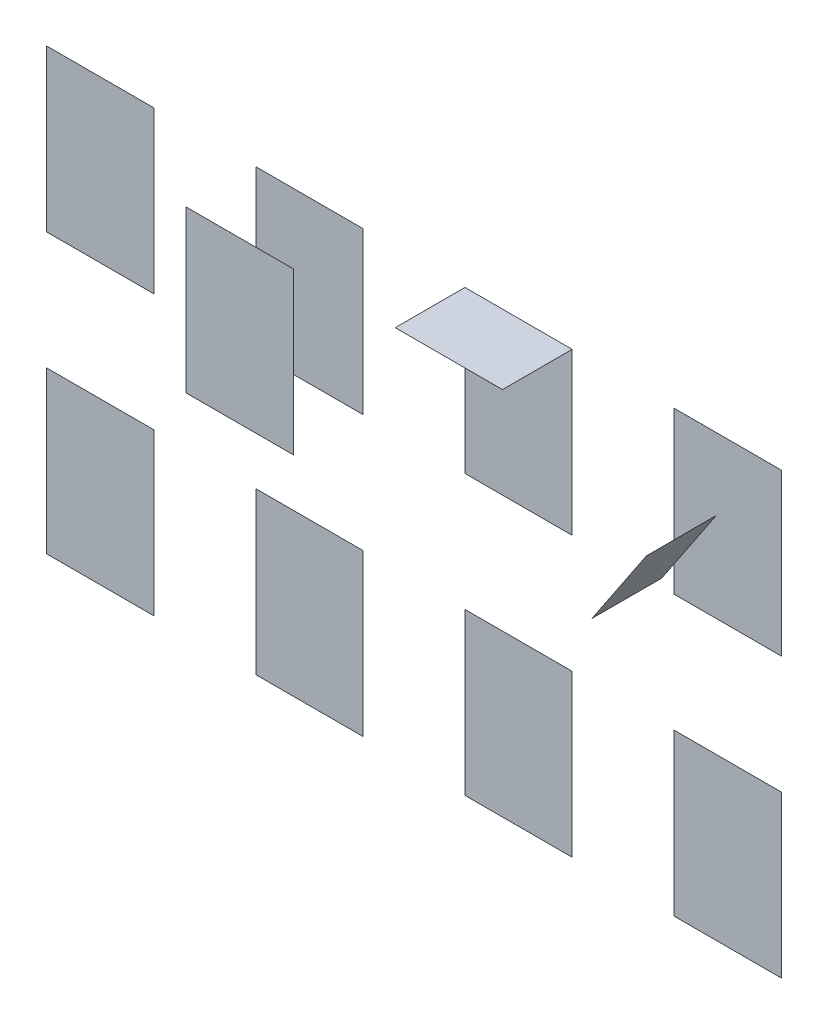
SolidWorks part; units mm, degrees
ref_plane "Front Plane" through (0, 0, 0) normal (0, 0, 1) x (1, 0, 0)
ref_plane "Top Plane" through (0, 0, 0) normal (0, 1, 0) x (1, 0, 0)
ref_plane "Right Plane" through (0, 0, 0) normal (1, 0, 0) x (0, 0, -1)
sketch "Sketch2" plane through (0, 0, 0) normal (0, 0, 1) x (1, 0, 0)
  line L0 (210.0743, 46.6612) -> (210.0743, -45.7795)
  line L1 (90.0743, 46.6612) -> (151.6014, 46.6612)
  line L2 (90.0743, 46.6612) -> (90.0743, -45.7795)
  line L3 (90.0743, -45.7795) -> (151.6014, -45.7795)
  line L4 (151.6014, 46.6612) -> (151.6014, -45.7795)
  line L5 (210.0743, 46.6612) -> (271.6014, 46.6612)
  line L6 (271.6014, 46.6612) -> (271.6014, -45.7795)
  line L7 (210.0743, -45.7795) -> (271.6014, -45.7795)
  line L8 (330.0743, 46.6612) -> (330.0743, -45.7795)
  line L9 (330.0743, 46.6612) -> (391.6014, 46.6612)
  line L10 (391.6014, 46.6612) -> (391.6014, -45.7795)
  line L11 (330.0743, -45.7795) -> (391.6014, -45.7795)
  line L12 (-29.9257, 46.6612) -> (-29.9257, -45.7795)
  line L13 (-29.9257, 46.6612) -> (31.6014, 46.6612)
  line L14 (31.6014, 46.6612) -> (31.6014, -45.7795)
  line L15 (-29.9257, -45.7795) -> (31.6014, -45.7795)
  line L16 (-29.9257, -113.3388) -> (-29.9257, -205.7795)
  line L17 (-29.9257, -205.7795) -> (31.6014, -205.7795)
  line L18 (31.6014, -113.3388) -> (31.6014, -205.7795)
  line L19 (-29.9257, -113.3388) -> (31.6014, -113.3388)
  line L20 (90.0743, -113.3388) -> (90.0743, -205.7795)
  line L21 (90.0743, -113.3388) -> (151.6014, -113.3388)
  line L22 (151.6014, -113.3388) -> (151.6014, -205.7795)
  line L23 (90.0743, -205.7795) -> (151.6014, -205.7795)
  line L24 (210.0743, -113.3388) -> (210.0743, -205.7795)
  line L25 (210.0743, -205.7795) -> (271.6014, -205.7795)
  line L26 (271.6014, -113.3388) -> (271.6014, -205.7795)
  line L27 (210.0743, -113.3388) -> (271.6014, -113.3388)
  line L28 (330.0743, -113.3388) -> (330.0743, -205.7795)
  line L29 (330.0743, -205.7795) -> (391.6014, -205.7795)
  line L30 (391.6014, -113.3388) -> (391.6014, -205.7795)
  line L31 (330.0743, -113.3388) -> (391.6014, -113.3388)
  dimension "D1" = 3
  dimension "D2" = 2
  dimension "D3" = 2
surface "Surface-Plane1" sketch "Sketch2"
surface "Surface-Offset1" parameters "D1"=40
sketch "Sketch4" plane through (0, 0, 0) normal (0, 0, 1) x (1, 0, 0)
  line L0 (210.0743, 46.6612) -> (271.6014, 46.6612)
surface "Surface-Extrude1" sketch "Sketch4" parameters "D1"=40
sketch "Sketch5" plane through (0, 0, 0) normal (0, 0, 1) x (1, 0, 0)
  line L0 (342.9451, -21.4127) -> (374.2528, 25.3638)
surface "Surface-Extrude2" sketch "Sketch5" parameters "D1"=40, "D19"=20
sketch "Sketch6" plane through (0, 0, 40) normal (0, 0, 1) x (1, 0, 0)
  line L0 (344.5056, -159.5592) -> (381.549, -159.5592)
  point P0 (242.3714, -159.5592)
sketch "Sketch7" plane through (0, 0, 0) normal (0, 0, 1) x (1, 0, 0)
  line L1 (97.4566, -155.3884) -> (136.0436, -155.3884)
  point P2 (-2.5019, -155.3884)
